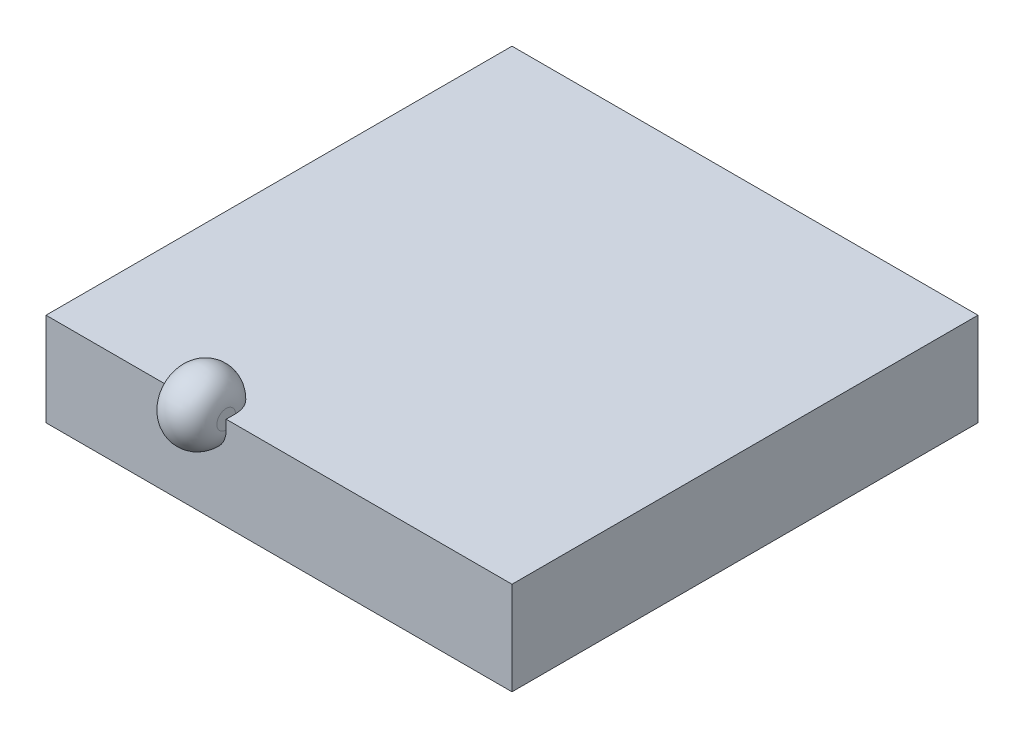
SolidWorks part; units mm, degrees
ref_plane "Front Plane" through (0, 0, 0) normal (0, 0, 1) x (1, 0, 0)
ref_plane "Top Plane" through (0, 0, 0) normal (0, 1, 0) x (1, 0, 0)
ref_plane "Right Plane" through (0, 0, 0) normal (1, 0, 0) x (0, 0, -1)
sketch "Sketch1" plane through (0, 0, 0) normal (0, 1, 0) x (1, 0, 0)
  line L1 (-75, -75) -> (75, -75)
  line L2 (-75, -75) -> (-75, 75)
  line L3 (-75, 75) -> (75, 75)
  line L4 (75, -75) -> (75, 75)
  line L5 (-75, -75) -> (75, 75) construction
  line L6 (-75, 75) -> (75, -75) construction
  point P0 (0, 0)
  dimension "D1" = 150
  dimension "D2" = 150
extrude "Boss-Extrude1" add sketch "Sketch1" along normal blind 30
sketch "Sketch2" plane through (0, 30, 0) normal (0, 1, 0) x (1, 0, 0)
  line L0 (-25, -75) -> (-25, 11)
  line L1 (9.5, 45.5) -> (75, 45.5)
  line L2 (75, -75) -> (75, 75) construction
  line L3 (-75, -75) -> (75, -75) construction
  line L5 (-75, 75) -> (-75, -75) construction
  arc A0 (9.5, 45.5) -> (-25, 11) centre (9.5, 11) ccw
  point P4 (0, 0)
  dimension "D1" = 34.5
  dimension "D2" = 86
  dimension "D3" = 50
sketch "Sketch3" plane through (0, 0, 75) normal (0, 0, 1) x (1, 0, 0)
  line L0 (-75, 30) -> (75, 30) construction
  line L1 (-33, 30) -> (-33, 27)
  line L2 (-33, 30) -> (-17, 30)
  line L3 (9.5, 30) -> (-25, 30) construction
  line L4 (-17, 27) -> (-17, 30)
  arc A1 (-33, 27) -> (-17, 27) centre (-25, 27) ccw
  point P10 (-19.6458, 25.735)
  point P11 (-85.4501, 27.5)
  point P12 (-25, 30)
  dimension "D1" = 8
  dimension "D2" = 3
revolve "Revolve1" add sketch "Sketch3" angle 360 about L2
